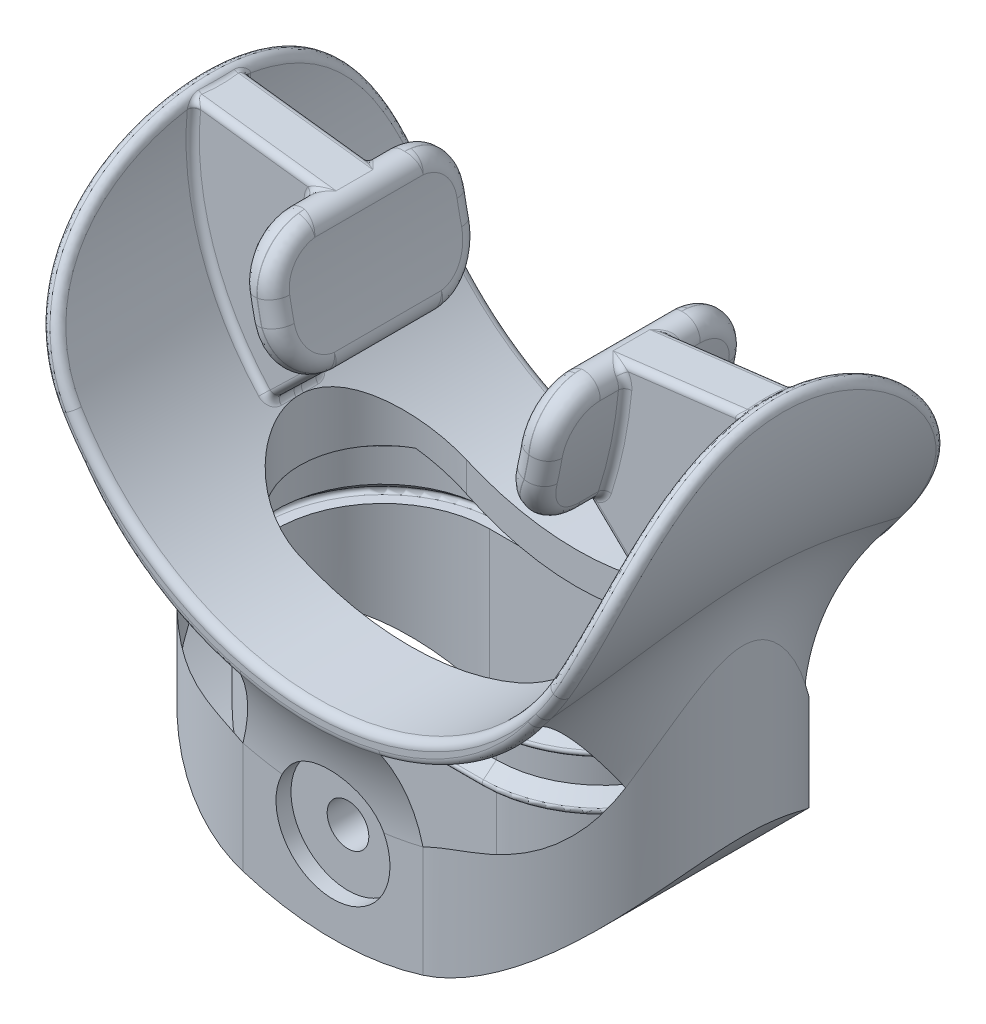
SolidWorks part; units mm, degrees
ref_plane "Plane1" through (0, 0, 0) normal (0, 0, 1) x (1, 0, 0)
ref_plane "Plane2" through (0, 0, 0) normal (0, 1, 0) x (1, 0, 0)
ref_plane "Plane3" through (0, 0, 0) normal (1, 0, 0) x (0, 0, -1)
sketch "Sketch1" plane through (0, 0, 0) normal (0, 0, 1) x (1, 0, 0)
  line L0 (0, 0) -> (0, -28.0192) construction
  line L1 (0, 0) -> (24.9701, 3.5093) construction
  line L2 (9.4244, 0) -> (-9.4244, 0) construction
  line L3 (-10.8602, -22.2504) -> (14.7698, -22.2504) construction
  line L4 (22.0339, 3.0967) -> (20.7762, 2.9199)
  line L5 (-22.0339, 3.0967) -> (-20.7762, 2.9199)
  arc A0 (-22.0339, 3.0967) -> (22.0339, 3.0967) centre (0, 0) ccw
  arc A1 (-20.7762, 2.9199) -> (20.7762, 2.9199) centre (0, 0) ccw
  dimension "D2" = 22.2504
  dimension "D1" = 8
  dimension "D3" = 1.27
extrude "Lip Backing" add sketch "Sketch1" along normal mid plane 27.94
ref_plane "Plane4" through (0, -76.2, 0) normal (0, 1, 0) x (-1, 0, 0)
sketch "Sketch2" plane through (0, -76.2, 0) normal (0, 1, 0) x (-1, 0, 0)
  line L0 (0, 0) -> (0, 15.4138) construction
  line L1 (0, 0) -> (-22.6786, 0) construction
  line L2 (-6.858, 12.192) -> (6.858, 12.192)
  line L3 (-6.858, -12.192) -> (6.858, -12.192)
  arc A0 (-19.05, 0) -> (-6.858, 12.192) centre (-6.858, 0) cw
  arc A1 (19.05, 0) -> (6.858, 12.192) centre (6.858, 0) ccw
  arc A2 (-19.05, 0) -> (-6.858, -12.192) centre (-6.858, 0) ccw
  arc A3 (19.05, 0) -> (6.858, -12.192) centre (6.858, 0) cw
  dimension "D1" = 12.192
  dimension "D2" = 19.05
extrude "Regulator Connector" add sketch "Sketch2" along normal up to next
fillet "Fillet1" radius 12.7 4 edges at (0, -22.2504, 12.192) (18.9744, -11.6212, -1.3558) (0, -22.2504, -12.192) (-18.9744, -11.6212, -1.3558)
sketch "Sketch4" plane through (0, 0, 0) normal (0, 0, 1) x (1, 0, 0)
  line L0 (19.304, -26.799) -> (19.304, -76.2)
  line L1 (19.304, -76.2) -> (-19.304, -76.2)
  line L2 (-19.304, -76.2) -> (-19.304, -26.799)
  line L3 (0, -12.1668) -> (0, 12.1668) construction
  line L4 (6.858, -76.2) -> (-6.858, -76.2) construction
  line L5 (19.05, -76.2) -> (19.05, -14.6105) construction
  arc A0 (19.304, -26.799) -> (-19.304, -26.799) centre (0, -14.5542) cw
  dimension "D3" = 22.86
  dimension "D1" = 0.254
  dimension "D2" = 14.5542
extrude "Trim Back of Reg. Connector" cut sketch "Sketch4" against normal through all and the other way through all
sketch "Sketch5" plane through (0, 0, 12.192) normal (0, 0, 1) x (1, 0, 0)
  line L0 (0, -12.1668) -> (0, 12.1668) construction
  circle A0 centre (0, -30.4292) radius 4.3434
  arc A1 (-6.858, -36.3613) -> (6.858, -36.3613) centre (0, -14.5542) ccw construction
  dimension "D2" = 4.3434
  dimension "D1" = 6.985
extrude "CBore for Snap Pin" cut sketch "Sketch5" against normal blind 1.143 and the other way through all
mirror "Mirror CBore" about plane through (0, 0, 0) normal (0, 0, 1) of "CBore for Snap Pin"
sketch "Sketch6" plane through (0, 0, 11.049) normal (0, 0, 1) x (1, 0, 0)
  circle A0 centre (0, -30.4292) radius 1.5875
  circle A1 centre (0, -30.4292) radius 4.3434 construction
  dimension "D1" = 3.175
extrude "Snap Pin Hole" cut sketch "Sketch6" against normal through all
ref_plane "Plane5" through (0, -30.4292, 0) normal (0, 1, 0) x (-1, 0, 0)
ref_plane "Plane6" through (0, -19.6088, 0) normal (0, 1, 0) x (-1, 0, 0)
sketch "Sketch7" plane through (0, -19.6088, 0) normal (0, 1, 0) x (-1, 0, 0)
  line L0 (12.1668, 0) -> (-12.1668, 0) construction
  line L1 (0, 12.1668) -> (0, -12.1668) construction
  line L4 (-8.382, 8.128) -> (8.382, 8.128)
  line L5 (8.382, -8.128) -> (-8.382, -8.128)
  arc A0 (-8.382, 8.128) -> (-8.382, -8.128) centre (-8.382, 0) ccw
  arc A2 (8.382, -8.128) -> (8.382, 8.128) centre (8.382, 0) ccw
  point P3 (0, 8.128)
  dimension "D2" = 8.128
  dimension "D1" = 16.764
extrude "Sleeve" cut sketch "Sketch7" against normal through all
sketch "Sketch13" plane through (0, -19.6088, 0) normal (0, 1, 0) x (-1, 0, 0)
  line L0 (0, 8.128) -> (-8.382, 8.128)
  line L1 (0, -8.128) -> (-8.382, -8.128)
  line L2 (0, 12.1668) -> (0, -12.1668) construction
  arc A0 (-8.382, -8.128) -> (-8.382, 8.128) centre (-8.382, 0) cw
  arc A1 (-8.382, 8.128) -> (-8.382, -8.128) centre (-8.382, 0) ccw construction
sketch "Sketch14" plane through (0, 0, 0) normal (1, 0, 0) x (0, 0, -1)
  line L0 (8.128, -19.6088) -> (8.128, -20.8788)
  line L1 (8.128, -20.8788) -> (8.9504, -20.8788)
  line L2 (8.128, -19.6088) -> (9.113, -20.4297)
  arc A0 (9.113, -20.4297) -> (8.9504, -20.8788) centre (8.9504, -20.6248) cw
  point P6 (9.652, -20.8788)
  dimension "D1" = 0.254
  dimension "D2" = 1.27
  dimension "D3" = 1.524
sweep "Rib1" cut profiles "Sketch14" path "Sketch13"
sketch "Sketch15" plane through (0, 0, 0) normal (1, 0, 0) x (0, 0, -1)
  line L0 (8.128, -23.4188) -> (8.128, -24.6888)
  line L1 (8.128, -24.6888) -> (8.9504, -24.6888)
  line L2 (8.128, -23.4188) -> (9.113, -24.2397)
  line L3 (8.128, -20.8788) -> (8.9504, -20.8788) construction
  arc A0 (9.113, -24.2397) -> (8.9504, -24.6888) centre (8.9504, -24.4348) cw
  point P6 (9.652, -24.6888)
  dimension "D1" = 0.254
  dimension "D2" = 1.27
  dimension "D3" = 1.524
  dimension "D4" = 3.81
sketch "Sketch16" plane through (0, -19.6088, 0) normal (0, 1, 0) x (-1, 0, 0)
  line L0 (0, -8.128) -> (-8.382, -8.128)
  line L1 (-8.382, 8.128) -> (0, 8.128)
  line L2 (0, 12.1668) -> (0, -12.1668) construction
  arc A0 (-8.382, -8.128) -> (-8.382, 8.128) centre (-8.382, 0) cw
  arc A1 (-8.382, 8.128) -> (-8.382, -8.128) centre (-8.382, 0) ccw construction
sweep "Rib2" cut profiles "Sketch15" path "Sketch16"
mirror "Mirror Ribs" about plane through (0, 0, 0) normal (1, 0, 0) of "Rib2", "Rib1"
sketch "Sketch17" plane through (0, 0, 0) normal (0, 0, 1) x (1, 0, 0)
  line L0 (-12.4111, -18.8468) -> (-12.4111, -16.9158)
  line L1 (12.4111, -18.8468) -> (12.4111, -16.9158)
  line L2 (8.382, -23.4188) -> (-8.382, -23.4188) construction
  line L3 (-16.51, -19.6088) -> (-8.382, -19.6088) construction
  arc A0 (-20.7762, 2.9199) -> (20.7762, 2.9199) centre (0, 0) ccw construction
  arc A1 (-12.4111, -16.9158) -> (12.4111, -16.9158) centre (0, 0) ccw
  arc A2 (12.4111, -18.8468) -> (-12.4111, -18.8468) centre (0, -4.2874) cw
  dimension "D1" = 19.1314
  dimension "D2" = 0.762
extrude "Clean up opening" add sketch "Sketch17" along normal up to next and the other way up to next
sketch "Sketch3" plane through (0, -76.2, 0) normal (0, 1, 0) x (-1, 0, 0)
  line L0 (-8.382, 6.35) -> (8.382, 6.35)
  line L1 (8.382, -6.35) -> (-8.382, -6.35)
  arc A0 (8.382, 6.35) -> (8.382, -6.35) centre (8.382, 0) cw
  arc A1 (-8.382, -6.35) -> (-8.382, 6.35) centre (-8.382, 0) cw
  arc A2 (-8.382, 8.128) -> (-8.382, -8.128) centre (-8.382, 0) ccw construction
  arc A3 (8.382, -8.128) -> (8.382, 8.128) centre (8.382, 0) ccw construction
  dimension "D1" = 6.35
extrude "Air Passage" cut sketch "Sketch3" along normal through all
sketch "Sketch12" plane through (0, 0, 0) normal (1, 0, 0) x (0, 0, -1)
  line L0 (-13.97, -11.0501) -> (-13.97, 5.6367)
  line L1 (-13.97, 5.6367) -> (13.97, 5.6367)
  line L2 (13.97, 5.6367) -> (13.97, -11.0501)
  line L3 (-13.97, 3.0967) -> (13.97, 3.0967) construction
  line L4 (13.97, -11.0501) -> (-13.97, -11.0501) construction
  line L5 (0, 12.1668) -> (0, -12.1668) construction
  line L6 (13.97, 3.0967) -> (13.97, -13.7645) construction
  line L7 (-13.97, 2.9199) -> (13.97, 2.9199) construction
  arc A0 (13.97, -11.0501) -> (-13.97, -11.0501) centre (0, -11.0501) ccw
  dimension "D1" = 2.54
extrude "Trim Lip Backing" cut sketch "Sketch12" against normal through all and the other way through all
fillet "Fillet 19" radius 0.635 22 edges at (-12.0523, -18.7036, -13.97) (0, -22.2504, -13.97) (12.0523, -18.7036, -13.97) (18.4473, -12.441, -13.97) (-12.0523, -18.7036, 13.97) (0, -22.2504, 13.97) (12.0523, -18.7036, 13.97) (18.4473, -12.441, 13.97) (-20.1759, -9.3815, -1.7009) (20.1759, -9.3815, 1.7009) (-18.4473, -12.441, -13.97) (0, -20.9804, -13.97) (18.5736, -11.0501, -13.97) (-18.5736, -11.0501, -13.97) (-18.4473, -12.441, 13.97) (0, -20.9804, 13.97) (18.5736, -11.0501, 13.97) (-18.5736, -11.0501, 13.97) (20.7797, 2.8951, 0.8327) (-20.7797, 2.8951, -0.8327) (22.0594, 2.909, 0.5521) (-22.0594, 2.909, -0.5521)
sketch "Sketch10" plane through (0, 0, 0) normal (0, 0, 1) x (1, 0, 0)
  line L0 (21.4543, 2.6343) -> (10.5532, 1.2958)
  line L1 (8.3485, -8.0621) -> (15.5488, -15.0153)
  line L2 (9.2307, -7.1485) -> (9.2307, -12.2239) construction
  line L3 (9.4244, 0) -> (-9.4244, 0) construction
  arc A0 (9.4433, 0.1512) -> (8.0229, -6.756) centre (-22.1488, 3.048) cw
  arc A1 (17.2407, -13.0378) -> (18.5774, -11.0501) centre (0, 0) ccw construction
  arc A2 (21.4543, 2.6343) -> (15.5488, -15.0153) centre (0, 0) cw
  arc A3 (9.4433, 0.1512) -> (10.5532, 1.2958) centre (10.708, 0.0352) cw
  arc A4 (8.3485, -8.0621) -> (8.0229, -6.756) centre (9.2307, -7.1485) cw
  dimension "D2" = 31.7246
  dimension "D5" = 1.27
  dimension "D6" = 7
  dimension "D1" = 46
  dimension "D3" = 22.1488
  dimension "D4" = 3.048
extrude "Bite" add sketch "Sketch10" along normal mid plane 3.81
sketch "Sketch11" plane through (0, 0, 0) normal (0, 0, 1) x (1, 0, 0)
  line L0 (21.0412, 2.5835) -> (10.5532, 1.2958) construction
  line L1 (12.0801, 1.4832) -> (10.5532, 1.2958)
  line L2 (8.3485, -8.0621) -> (15.092, -14.5742) construction
  line L3 (8.3485, -8.0621) -> (9.7636, -9.4286)
  arc A0 (8.0229, -6.756) -> (9.4433, 0.1512) centre (-22.1488, 3.048) ccw construction
  arc A1 (8.0229, -6.756) -> (9.4433, 0.1512) centre (-22.1488, 3.048) ccw
  arc A2 (12.0801, 1.4832) -> (9.7636, -9.4286) centre (-22.1488, 3.048) cw
  arc A3 (10.5532, 1.2958) -> (9.4433, 0.1512) centre (10.708, 0.0352) ccw construction
  arc A4 (10.5532, 1.2958) -> (9.4433, 0.1512) centre (10.708, 0.0352) ccw
  arc A5 (8.0229, -6.756) -> (8.3485, -8.0621) centre (9.2307, -7.1485) ccw construction
  arc A6 (8.0229, -6.756) -> (8.3485, -8.0621) centre (9.2307, -7.1485) ccw
extrude "Behind Teeth" add sketch "Sketch11" along normal mid plane 15.24
mirror "Mirror3" about plane through (0, 0, 0) normal (1, 0, 0) of "Behind Teeth", "Bite"
fillet "Fillet3" radius 3.81 16 edges at (7.9985, -7.4557, -7.62) (9.056, -8.7453, -7.62) (11.3166, 1.3895, -7.62) (9.7962, 0.9194, -7.62) (7.9985, -7.4557, 7.62) (9.056, -8.7453, 7.62) (11.3166, 1.3895, 7.62) (9.7962, 0.9194, 7.62) (-7.9985, -7.4557, 7.62) (-9.7962, 0.9194, 7.62) (-11.3166, 1.3895, 7.62) (-9.056, -8.7453, 7.62) (-7.9985, -7.4557, -7.62) (-9.056, -8.7453, -7.62) (-11.3166, 1.3895, -7.62) (-9.7962, 0.9194, -7.62)
fillet "Fillet6" radius 1.27 28 edges at (9.7636, -9.4286, -2.8575) (12.0801, 1.4832, -2.8575) (-12.0801, 1.4832, -2.8575) (-9.7636, -9.4286, -2.8575) (-9.7636, -9.4286, 2.8575) (-9.056, -8.7453, -3.81) (-9.056, -8.7453, 3.81) (-12.0801, 1.4832, 2.8575) (-11.4036, -3.902, 7.62) (-11.9864, 0.0725, 6.7517) (-10.0414, -8.693, 6.0418) (-11.4036, -3.902, -7.62) (-12.0325, 0.66, -6.1603) (-10.219, -8.1943, -6.5896) (11.4036, -3.902, 7.62) (12.0801, 1.4832, 2.8575) (9.7636, -9.4286, 2.8575) (12.0325, 0.66, 6.1603) (10.219, -8.1943, 6.5896) (9.056, -8.7453, -3.81) (9.056, -8.7453, 3.81) (11.4036, -3.902, -7.62) (11.9864, 0.0725, -6.7517) (10.0414, -8.693, -6.0418) (-11.3166, 1.3895, 3.81) (-11.3166, 1.3895, -3.81) (11.3166, 1.3895, 3.81) (11.3166, 1.3895, -3.81)
fillet "Fillet8" radius 1.2446 20 edges at (-8.9887, -3.0273, 7.62) (-8.9887, -3.0273, -7.62) (-9.3313, -0.8827, 7.1698) (-9.2606, -1.4126, -7.3988) (-8.3252, -5.7716, -6.9357) (-8.4901, -5.1807, 7.2495) (-7.9848, -7.3946, -5.1068) (-7.9848, -7.3946, 5.1068) (8.9887, -3.0273, 7.62) (7.9848, -7.3946, -5.1068) (7.9848, -7.3946, 5.1068) (8.9887, -3.0273, -7.62) (9.2606, -1.4126, 7.3988) (9.3313, -0.8827, -7.1698) (8.4901, -5.1807, -7.2495) (8.3252, -5.7716, 6.9357) (-9.6252, 0.6989, 5.66) (-9.6252, 0.6989, -5.66) (9.6252, 0.6989, 5.66) (9.6252, 0.6989, -5.66)
fillet "Fillet27" radius 0.508 7 edges at (-20.8914, 2.3015, -1.905) (-20.9365, 2.5707, -0.6357) (-20.8914, 2.3015, 1.905) (-15.7972, 1.9397, 1.905) (-15.7972, 1.9397, -1.905) (-11.7203, -11.3181, -1.905) (-11.7203, -11.3181, 1.905)
fillet "Fillet28" radius 0.508 21 edges at (-20.6782, -3.548, 11.0969) (-11.4135, -3.8536, 1.905) (-11.4135, -3.8536, -1.905) (-11.9065, 0.4553, 1.905) (-10.0566, -8.1133, -1.905) (-20.9365, 2.5707, -0.6357) (-19.8962, -6.6572, 1.905) (-10.0566, -8.1133, 1.905) (-11.9065, 0.4553, -1.905) (-19.8962, -6.6572, -1.905) (-15.092, -14.5742, 0) (-11.1242, 1.2351, 1.7362) (-20.905, 2.3685, 1.7986) (-11.1242, 1.2351, -1.7362) (-20.9529, 2.4978, -1.6615) (-15.1692, -14.4939, 1.7143) (-8.841, -8.3572, 1.7362) (-15.2239, -14.4364, -1.7937) (-8.841, -8.3572, -1.7362)
fillet "Fillet29" radius 0.508 7 edges at (20.952, 2.4584, -1.905) (20.9365, 2.5707, -0.6357) (20.952, 2.4584, 1.905) (15.7972, 1.9397, -1.905) (15.7972, 1.9397, 1.905) (11.7203, -11.3181, -1.905) (11.7203, -11.3181, 1.905)
fillet "Fillet30" radius 0.508 21 edges at (20.6782, -3.548, -11.0969) (11.4135, -3.8536, 1.905) (11.4135, -3.8536, -1.905) (10.0566, -8.1133, 1.905) (11.9065, 0.4553, -1.905) (11.9065, 0.4553, 1.905) (19.8962, -6.6572, 1.905) (15.092, -14.5742, 0) (19.8962, -6.6572, -1.905) (10.0566, -8.1133, -1.905) (20.9365, 2.5707, -0.6357) (15.2239, -14.4364, 1.7937) (8.841, -8.3572, 1.7362) (15.1692, -14.4939, -1.7143) (8.841, -8.3572, -1.7362) (11.1242, 1.2351, 1.7362) (20.9529, 2.4978, 1.6615) (11.1242, 1.2351, -1.7362) (20.905, 2.3685, -1.7986)
fillet "Fillet31" radius 0.254
fillet "Fillet32" radius 0.254
fillet "Fillet33" radius 0.508
